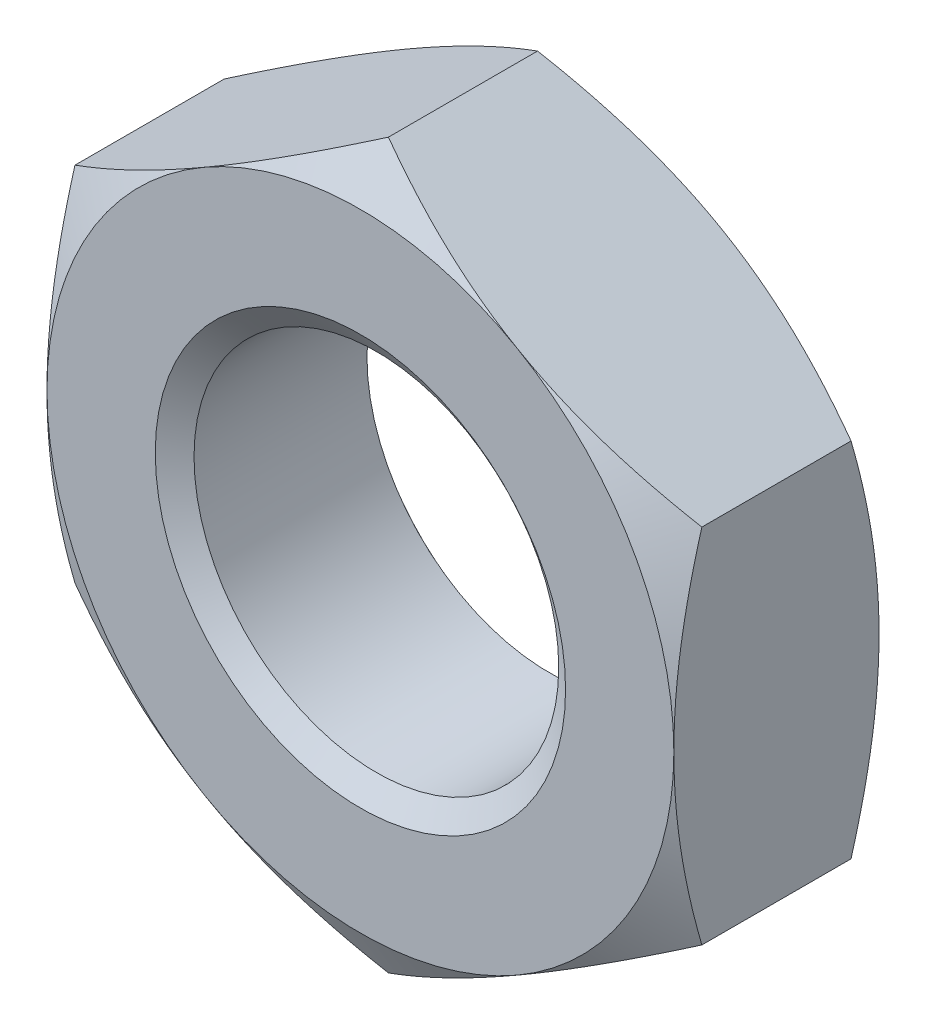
SolidWorks part; units mm, degrees
ref_plane "Plane1" through (0, 0, 0) normal (0, 0, 1) x (1, 0, 0)
ref_plane "Plane2" through (0, 0, 0) normal (0, 1, 0) x (1, 0, 0)
ref_plane "Plane3" through (0, 0, 0) normal (1, 0, 0) x (0, 0, -1)
revolve "EndChamfer" cut sketch "Sketch5"
sketch "Sketch5"
  line L0 (17.9746, 18) -> (16.4341, 15.8)
  line L1 (18.0254, 18) -> (17.9746, 18)
  line L2 (18.0254, 18) -> (18.0254, 15.8)
  line L3 (18.0254, 15.8) -> (16.4341, 15.8)
  line L6 (-0.0508, 18) -> (0, 18)
  line L7 (0, 18) -> (1.5405, 15.8)
  line L9 (1.5405, 15.8) -> (-0.0508, 15.8)
  line L10 (-0.0508, 15.8) -> (-0.0508, 18)
  line L11 (25.0375, 0) -> (38.388, 0) construction
  line L12 (18, 0) -> (0, 0) construction
extrude "BaseNut" add sketch "BaseNutSke" against normal blind 18
sketch "BaseNutSke" plane through (0, 0, 0) normal (0, 0, 1) x (1, 0, 0)
  line L6 (27.5, 15.8771) -> (27.5, -15.8771)
  line L7 (-27.5, 15.8771) -> (-27.5, -15.8771)
  line L8 (27.5, 15.8771) -> (0, 31.7543)
  line L9 (0, 31.7543) -> (-27.5, 15.8771)
  line L10 (-27.5, -15.8771) -> (0, -31.7543)
  line L11 (0, -31.7543) -> (27.5, -15.8771)
  circle A0 centre (0, 0) radius 16
  dimension "D4" = 27.5
  dimension "Tap_drill" = 32
  dimension "D1" = 120
  dimension "D2" = 27.5
  dimension "D3" = 27.5
  dimension "Width_flats" = 55
pattern_linear "ThdSchPat"
revolve "ThreadSchematic" cut sketch "ThdSchSke" angle 360 about L11
sketch "ThdSchSke" plane through (0, 0, 0) normal (0, 1, 0) x (1, 0, 0)
  line L0 (-18, 0.0254) -> (-16, 1.4258)
  line L1 (-16, 1.4258) -> (-8, 1.4258)
  line L2 (-8, 1.4258) -> (-8, -1.375)
  line L3 (-8, -1.375) -> (-16, -1.375)
  line L4 (-16, -1.375) -> (-18, 0.0254)
  line L5 (-3.175, 3.175) -> (3.175, 3.175) construction
  line L6 (0, 3.175) -> (0, -2.9874) construction
  line L7 (0, 16.5742) -> (0, 1.4004) construction
  dimension "D1" = 35
  dimension "VeeAngle" = 70
  dimension "SideAngle" = 55
  dimension "D2" = 0.0508
  dimension "OverCut" = 16
  dimension "Tap_Drill" = 32
  dimension "Advance" = 2.9915
  dimension "Thread_major" = 36
  dimension "Num_threads" = 7
  dimension "D4" = 50
  dimension "Offset1" = 18.0254
  dimension "ThreadMajor" = 18
  dimension "ChamferDepth" = 2.2
  dimension "Offset2" = 18.0762
sketch "Sketch4" plane through (0, 0, 0) normal (1, 0, 0) x (0, 0, -1)
  line L0 (18, 27.5) -> (17.5936, 27.5)
  line L1 (18, 27.5) -> (18, 41.7543)
  line L2 (17.5936, 41.7543) -> (18, 41.7543)
  line L3 (17.5936, 41.7543) -> (17.5936, 27.5)
  line L4 (0, 0) -> (34.925, 0) construction
  line L6 (18, 15.8771) -> (18, 31.7543) construction
  line L7 (0, 27.5) -> (-10, 27.5)
  line L8 (0, 15.8771) -> (0, 31.7543) construction
  line L9 (2.4562, 31.7543) -> (2.4562, 41.7543)
  line L10 (2.4562, 41.7543) -> (-10, 41.7543)
  line L11 (-10, 41.7543) -> (-10, 27.5)
  line L12 (0, 27.5) -> (2.4562, 31.7543)
  line L14 (0, 15.8771) -> (0, -15.8771) construction
  line L15 (18, 31.7543) -> (0, 31.7543) construction
  dimension "D1" = 27.5
  dimension "D2" = 30
  dimension "Bearing_ht" = 0.4064
  dimension "D3" = 10
  dimension "D4" = 10
revolve "Bearing-Face" cut sketch "Sketch4" angle 360 about L4
sketch "Sketch3" plane through (0, 0, 0) normal (1, 0, 0) x (0, 0, -1)
  line L0 (18, 27.5) -> (15.5438, 31.7543)
  line L1 (15.5438, 31.7543) -> (15.5438, 41.7543)
  line L2 (15.5438, 41.7543) -> (28, 41.7543)
  line L3 (28, 41.7543) -> (28, 27.5)
  line L4 (28, 27.5) -> (18, 27.5)
  line L5 (18, 15.8771) -> (18, 31.7543) construction
  line L6 (18, 31.7543) -> (0, 31.7543) construction
  line L7 (0, 0) -> (38.6776, 0) construction
  line L8 (18, 0) -> (0, 0) construction
  line L9 (9, 31.7543) -> (9, 44.222) construction
  line L10 (2.4562, 41.7543) -> (-10, 41.7543)
  line L11 (-10, 41.7543) -> (-10, 27.5)
  line L12 (-10, 27.5) -> (0, 27.5)
  line L13 (0, 27.5) -> (2.4562, 31.7543)
  line L14 (2.4562, 31.7543) -> (2.4562, 41.7543)
  line L16 (18, 31.7543) -> (0, 31.7543) construction
  dimension "D1" = 27.5
  dimension "D2" = 30
  dimension "D3" = 10
  dimension "D4" = 10
revolve "Double-Chamfer" cut sketch "Sketch3" angle 360 about L7
equation "\"D2@BaseNutSke\" = \"Width_flats@BaseNutSke\" / 2"
equation "\"D3@BaseNutSke\" = \"Width_flats@BaseNutSke\" / 2"
equation "\"D1@Sketch3\" = \"Width_flats@BaseNutSke\" /2"
equation "\"D1@Sketch4\" = \"D2@BaseNutSke\""
equation "\"D4@BaseNutSke\" = \"D3@BaseNutSke\""
equation "\"Thread_major@ThdSchSke\" = \"Thread_major@ThreadCosmetic\""
equation "\"Tap_drill@ThdSchSke\" = \"Tap_drill@BaseNutSke\""
equation "\"Overcut@ThdSchSke\" = \"Tap_drill@ThdSchSke\" * 0.5"
equation "\"Num_threads@ThdSchPat\" = int(  ( \"Thickness@BaseNut\" - 0.0508 ) / \"Advance@ThdSchSke\" + 0.999 )  + 1"
equation "\"Advance@ThdSchPat\" = ( \"Thickness@BaseNut\" - 0.0508 ) /  (\"Num_threads@ThdSchPat\" - 1) 'relax it"
equation "' \"Num_threads@ThdSchPat\" = \"Num_threads@ThdSchPat\" - sgn( \"Num_threads@ThdSchPat\" - 1) '---chamfered tips only---"
equation "\"ThreadMajor@Sketch5\" = \"Thread_major@ThreadCosmetic\" * 0.5"
equation "\"ChamferDepth@Sketch5\" = (\"Thread_major@ThreadCosmetic\" - \"Tap_drill@BaseNutSke\") * 0.55"
equation "\"Offset1@Sketch5\" = \"Thickness@BaseNut\" + 0.0254"
equation "\"Offset2@Sketch5\" = \"Offset1@Sketch5\" + 0.0508"
